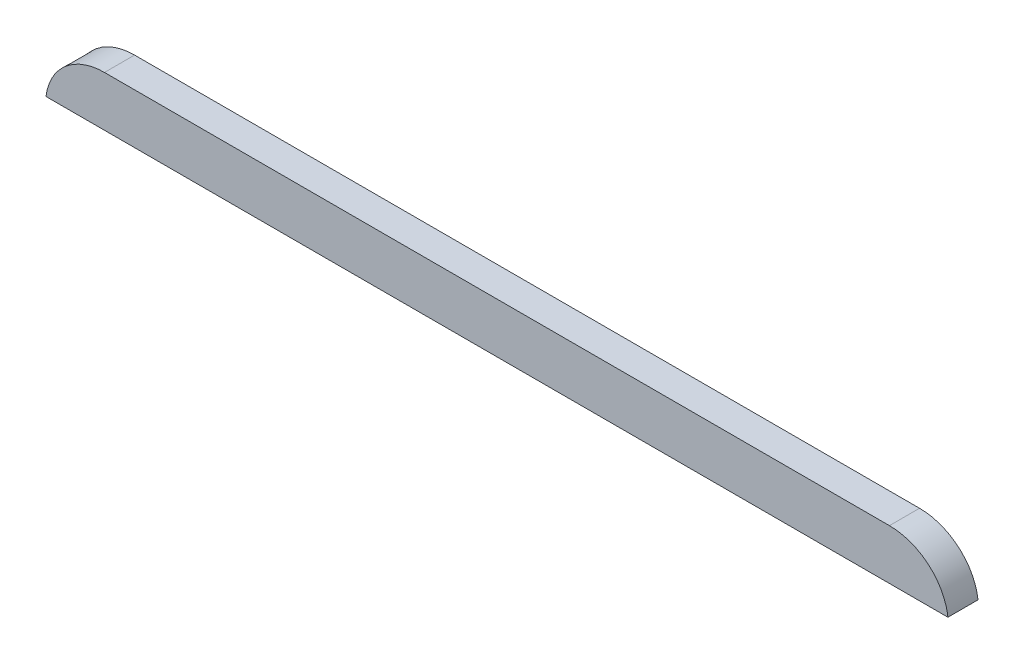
SolidWorks part; units mm, degrees
ref_plane "Front Plane" through (0, 0, 0) normal (0, 0, 1) x (1, 0, 0)
ref_plane "Top Plane" through (0, 0, 0) normal (0, 1, 0) x (1, 0, 0)
ref_plane "Right Plane" through (0, 0, 0) normal (1, 0, 0) x (0, 0, -1)
sketch "Sketch1" plane through (0, 0, 0) normal (0, 0, 1) x (1, 0, 0)
  line L10 (-300, 359.4636) -> (300, 359.4636)
  line L11 (-344.6989, 321.1673) -> (344.6989, 321.1673)
  spline S1 degree 3 poles (-911.198, -2378.5861) (-612.1721, -2368.1704) (16.2024, 409.3228) (309.2888, 358.5543) (310.5972, 358.2689) (312.5494, 357.7524) (313.1993, 357.5652) (314.4838, 357.1648) (315.1197, 356.9513) (318.2687, 355.8192) (320.6897, 354.707) (324.1681, 352.716) (325.302, 351.9984) (327.5168, 350.4516) (328.5876, 349.6294) (331.6889, 347.0201) (333.574, 345.1153) (336.1285, 342.0119) (336.9341, 340.9353) (338.4501, 338.6987) (339.1504, 337.5538) (341.0788, 334.0402) (342.1425, 331.596) (343.3823, 327.7665) (343.7369, 326.4574) (389.2341, 118.9613) (-1151.5303, -326.2841) (3267.0406, 126.7042) knots -13.739146 -13.739146 -13.739146 -13.739146 0.125 0.125 0.1875 0.1875 0.21875 0.21875 0.25 0.25 0.375 0.375 0.4375 0.4375 0.5 0.5 0.625 0.625 0.6875 0.6875 0.75 0.75 0.875 0.875 0.9375 0.9375 10.734768 10.734768 10.734768 10.734768 only from (300, 359.4636) to (344.6989, 321.1673) construction
  spline S2 degree 3 poles (300, 359.4636) (302.6849, 359.4636) (305.3429, 359.2378) (309.2888, 358.5543) (310.5972, 358.2689) (312.5494, 357.7524) (313.1993, 357.5652) (314.4838, 357.1648) (315.1197, 356.9513) (318.2687, 355.8192) (320.6897, 354.707) (324.1681, 352.716) (325.302, 351.9984) (327.5168, 350.4516) (328.5876, 349.6294) (331.6889, 347.0201) (333.574, 345.1153) (336.1285, 342.0119) (336.9341, 340.9353) (338.4501, 338.6987) (339.1504, 337.5538) (341.0788, 334.0402) (342.1425, 331.596) (343.3823, 327.7665) (343.7369, 326.4574) (344.3137, 323.8268) (344.5376, 322.5018) (344.6989, 321.1673) knots 0 0 0 0 0.125 0.125 0.1875 0.1875 0.21875 0.21875 0.25 0.25 0.375 0.375 0.4375 0.4375 0.5 0.5 0.625 0.625 0.6875 0.6875 0.75 0.75 0.875 0.875 0.9375 0.9375 1 1 1 1
  spline S3 degree 3 poles (-3236.1826, 99.9342) (1538.414, -475.789) (-394.8311, 94.1172) (-343.729, 326.4896) (-343.3761, 327.7876) (-342.1381, 331.6058) (-341.0737, 334.0527) (-339.4573, 336.9936) (-339.1192, 337.5757) (-338.4132, 338.7276) (-338.0458, 339.2964) (-336.9077, 340.9716) (-336.0989, 342.0506) (-334.3806, 344.1325) (-333.4693, 345.1379) (-331.5754, 347.0433) (-330.5899, 347.9473) (-327.523, 350.5196) (-325.333, 352.0506) (-322.4059, 353.7243) (-321.8103, 354.0473) (-320.6089, 354.6643) (-320.0021, 354.959) (-318.1634, 355.8022) (-316.9135, 356.3098) (-314.3663, 357.2185) (-313.0813, 357.6149) (-310.5016, 358.2907) (-309.2049, 358.5709) (-41.8994, 404.4372) (504.8675, -1898.7547) (837.5743, -2411.2799) knots -10.858277 -10.858277 -10.858277 -10.858277 0.0625 0.0625 0.125 0.125 0.25 0.25 0.28125 0.28125 0.3125 0.3125 0.375 0.375 0.4375 0.4375 0.5 0.5 0.625 0.625 0.65625 0.65625 0.6875 0.6875 0.75 0.75 0.8125 0.8125 0.875 0.875 13.629262 13.629262 13.629262 13.629262 only from (-344.6989, 321.1673) to (-300, 359.4636) construction
  spline S4 degree 3 poles (-344.6989, 321.1673) (-344.5364, 322.5116) (-344.3106, 323.845) (-343.729, 326.4896) (-343.3761, 327.7876) (-342.1381, 331.6058) (-341.0737, 334.0527) (-339.4573, 336.9936) (-339.1192, 337.5757) (-338.4132, 338.7276) (-338.0458, 339.2964) (-336.9077, 340.9716) (-336.0989, 342.0506) (-334.3806, 344.1325) (-333.4693, 345.1379) (-331.5754, 347.0433) (-330.5899, 347.9473) (-327.523, 350.5196) (-325.333, 352.0506) (-322.4059, 353.7243) (-321.8103, 354.0473) (-320.6089, 354.6643) (-320.0021, 354.959) (-318.1634, 355.8022) (-316.9135, 356.3098) (-314.3663, 357.2185) (-313.0813, 357.6149) (-310.5016, 358.2907) (-309.2049, 358.5709) (-305.2944, 359.2419) (-302.6605, 359.4636) (-300, 359.4636) knots 0 0 0 0 0.0625 0.0625 0.125 0.125 0.25 0.25 0.28125 0.28125 0.3125 0.3125 0.375 0.375 0.4375 0.4375 0.5 0.5 0.625 0.625 0.65625 0.65625 0.6875 0.6875 0.75 0.75 0.8125 0.8125 0.875 0.875 1 1 1 1
extrude "Boss-Extrude1" add sketch "Sketch1" along normal blind 23
